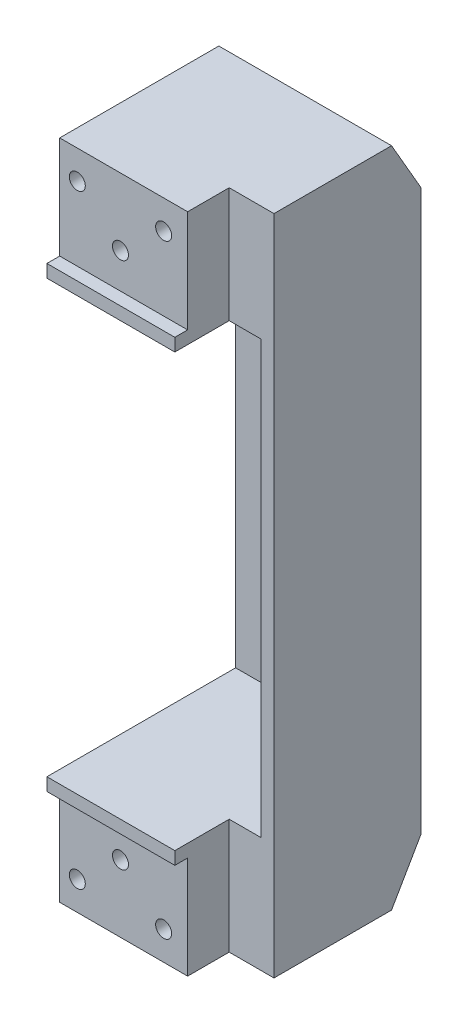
SolidWorks part; units mm, degrees
ref_plane "Спереди" through (0, 0, 0) normal (0, 0, 1) x (1, 0, 0)
ref_plane "Сверху" through (0, 0, 0) normal (0, 1, 0) x (1, 0, 0)
ref_plane "Справа" through (0, 0, 0) normal (1, 0, 0) x (0, 0, -1)
sketch "Эскиз1" plane through (0, 0, 0) normal (0, 1, 0) x (1, 0, 0)
  line L0 (54, 13) -> (40, 13)
  line L2 (0, 0) -> (0, 59)
  line L3 (0, 59) -> (54, 59)
  line L7 (40, 13) -> (40, 0)
  line L8 (0, 0) -> (40, 0)
  line L9 (54, 13) -> (54, 59)
  dimension "D1" = 54
  dimension "D2" = 59
  dimension "D3" = 13
  dimension "D4" = 14
extrude "Бобышка-Вытянуть1" add sketch "Эскиз1" against normal blind 32
sketch "Эскиз2" plane through (0, -32, 0) normal (0, -1, 0) x (1, 0, 0)
  line L6 (54, -59) -> (54, -13)
  line L7 (54, -13) -> (40, -13)
  line L8 (40, -13) -> (40, 0)
  line L9 (40, 0) -> (0, 0)
  line L10 (0, 0) -> (0, -59)
  line L11 (0, -59) -> (54, -59)
  line L12 (54, -59) -> (54, -13)
  line L13 (54, -13) -> (40, -13)
  line L14 (40, -13) -> (40, 4)
  line L15 (40, 4) -> (0, 4)
  line L16 (0, 4) -> (0, -59)
  line L17 (0, -59) -> (54, -59)
  dimension "D2" = 17
  dimension "D3" = 40
  dimension "D1" = 0
extrude "Бобышка-Вытянуть2" add sketch "Эскиз2" along normal blind 4
sketch "Эскиз3" plane through (0, -36, 0) normal (0, -1, 0) x (1, 0, 0)
  line L0 (0, -55) -> (50, -55)
  line L6 (0, -59) -> (54, -59)
  line L7 (54, -59) -> (54, -13)
  line L8 (54, -13) -> (40, -13)
  line L9 (40, -13) -> (40, 4)
  line L10 (40, 4) -> (0, 4)
  line L11 (0, 4) -> (0, -59)
  line L12 (0, -59) -> (54, -59)
  line L18 (36, 0) -> (4, 0) construction
  line L19 (36, -17) -> (36, 0) construction
  line L20 (50, -17) -> (36, -17) construction
  line L21 (50, -55) -> (50, -17) construction
  line L22 (4, 0) -> (4, -55) construction
  line L23 (4, -55) -> (50, -55) construction
  line L24 (40, 4) -> (0, 4) construction
  line L25 (54, -13) -> (40, -13) construction
  line L26 (40, -13) -> (40, 4) construction
  line L27 (54, -59) -> (54, -13) construction
  line L30 (0, 4) -> (0, -59) construction
  line L31 (0, -59) -> (0, -55)
  line L32 (54, -59) -> (54, -13) construction
  line L33 (54, -59) -> (54, -13)
  line L34 (54, -13) -> (50, -13)
  line L35 (54, -13) -> (40, -13) construction
  line L36 (50, -13) -> (50, -55)
  dimension "D3" = 4
  dimension "D1" = 0
  dimension "D2" = 4
extrude "Бобышка-Вытянуть3" add sketch "Эскиз3" along normal blind 135
hole_wizard "Отверстие обработанное метчиком M6x1.01" positions "Эскиз5" profile "Эскиз6" tap size "M6x1.0" standard "Ansi Metric"
sketch "Эскиз5" plane through (0, 0, 0) normal (0, 0, 1) x (1, 0, 0)
  line L0 (5.5, -9) -> (32.5, -9) construction
  line L2 (19, -9) -> (19, -21) construction
  line L4 (0, 0) -> (40, 0) construction
  line L5 (0, -32) -> (0, 0) construction
  point P0 (5.5, -9)
  point P3 (32.5, -9)
  point P6 (19, -21)
  dimension "D1" = 27
  dimension "D2" = 12
  dimension "D3" = 9
  dimension "D4" = 5.5
sketch "Эскиз6" plane through (5.5, -9, 0) normal (1, 0, 0) x (0, -1, 0)
  line L0 (0, 0) -> (0, 19.5022)
  line L1 (0, 19.5022) -> (2.5, 18)
  line L2 (2.5, 18) -> (2.5, 0)
  line L5 (2.5, 0) -> (0, 0)
  line L10 (0, 19.5022) -> (-2.5, 18) construction
  line L11 (0, -6.35) -> (0, 107.95) construction
  dimension "Диаметр сверла" = 5
  dimension "Глубина сверла" = 18
  dimension "Угол заточки сверла" = 118
ref_plane "Плоскость1" through (0, -103.5, 0) normal (0, -1, 0) x (-1, 0, 0)
mirror "Зеркальное отражение2" about plane through (0, -103.5, 0) normal (0, -1, 0) of "Бобышка-Вытянуть2", "Бобышка-Вытянуть1"
sketch "Эскиз4" plane through (0, -175, 0) normal (0, -1, 0) x (1, 0, 0)
  line L0 (0, 0) -> (40, 0)
  line L6 (0, -59) -> (54, -59)
  line L7 (54, -59) -> (54, -13)
  line L8 (54, -13) -> (40, -13)
  line L9 (40, -13) -> (40, 4)
  line L10 (40, 4) -> (0, 4)
  line L11 (0, 4) -> (0, -59)
  line L12 (0, -59) -> (54, -59)
  line L13 (54, -59) -> (54, -13)
  line L14 (54, -13) -> (40, -13)
  line L15 (40, -13) -> (40, 0)
  line L17 (0, 0) -> (0, -59)
  dimension "D2" = 13
  dimension "D3" = 59
  dimension "D4" = 14
  dimension "D1" = 0
extrude "Бобышка-Вытянуть4" add sketch "Эскиз4" along normal blind 32
chamfer "Фаска1" distance 16 angle 30 2 edges at (27, 0, -59) (27, -207, -59)
hole_wizard "Отверстие обработанное метчиком M6x1.02" positions "Эскиз11" profile "Эскиз8" tap size "M6x1.0" standard "Ansi Metric"
sketch "Эскиз11" plane through (0, 0, 0) normal (0, 0, 1) x (1, 0, 0)
  line L0 (32.5, -198) -> (5.5, -198) construction
  line L2 (19, -186) -> (19, -198) construction
  line L4 (0, -207) -> (0, -175) construction
  line L5 (40, -207) -> (0, -207) construction
  point P0 (32.5, -198)
  point P2 (5.5, -198)
  point P4 (19, -186)
  dimension "D1" = 27
  dimension "D2" = 12
  dimension "D3" = 5.5
  dimension "D4" = 9
sketch "Эскиз8" plane through (32.5, -198, 0) normal (1, 0, 0) x (0, -1, 0)
  line L0 (0, 0) -> (0, 21.5022)
  line L1 (0, 21.5022) -> (2.5, 20)
  line L2 (2.5, 20) -> (2.5, 0)
  line L5 (2.5, 0) -> (0, 0)
  line L10 (0, 21.5022) -> (-2.5, 20) construction
  line L11 (0, -6.35) -> (0, 107.95) construction
  dimension "Диаметр сверла" = 5
  dimension "Глубина сверла" = 20
  dimension "Угол заточки сверла" = 118
